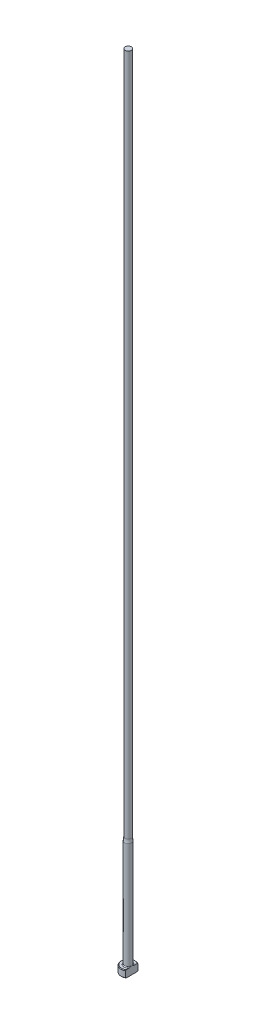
SolidWorks part; units mm, degrees
ref_plane "Front Plane" through (0, 0, 0) normal (0, 0, 1) x (1, 0, 0)
ref_plane "Top Plane" through (0, 0, 0) normal (0, 1, 0) x (1, 0, 0)
ref_plane "Right Plane" through (0, 0, 0) normal (1, 0, 0) x (0, 0, -1)
sketch "Sketch1" plane through (0, 0, 0) normal (0, 0, 1) x (1, 0, 0)
  line L0 (0, 259.9588) -> (0, -15.1925) construction
  line L1 (0, 0) -> (-3.175, 0)
  line L2 (-3.175, 0) -> (-3.175, 3.175)
  line L3 (-3.175, 3.175) -> (-1.5875, 3.175)
  line L4 (-1.3881, 52.3788) -> (-1.3881, 355.6)
  line L5 (-1.3881, 355.6) -> (0, 355.6)
  line L6 (0, 355.6) -> (0, 0)
  line L7 (-1.5875, 3.175) -> (-1.5875, 50.8)
  arc A0 (-1.5875, 50.8) -> (-1.3881, 52.3788) centre (-7.7381, 52.3788) ccw
  point P13 (-1.5875, 0)
  dimension "D1" = 6.35
  dimension "L" = 355.6
  dimension "D2" = 3.175
  dimension "H" = 6.35
  dimension "T" = 3.175
  dimension "D" = 2.7762
  dimension "S" = 50.8
revolve "Revolve1" add sketch "Sketch1" angle 360 about L0
chamfer "Chamfer1" distance 0.254 angle 45 2 edges at (0, 3.175, 3.175) (0, 0, 3.175)
fillet "Fillet1" radius 0.381 1 edges at (0, 3.175, 1.5875)
sketch "Sketch2" plane through (0, 0, 0) normal (0, 1, 0) x (1, 0, 0)
  line L0 (1.5875, -2.7496) -> (1.5875, 2.7496)
  circle A0 centre (0, 0) radius 3.175 construction
  arc A2 (1.5875, -2.7496) -> (1.5875, 2.7496) centre (0, 0) ccw
  circle A3 centre (0, 0) radius 3.175 construction
  circle A4 centre (0, 0) radius 1.5875 construction
extrude "Key Head" cut sketch "Sketch2" along normal up to next
